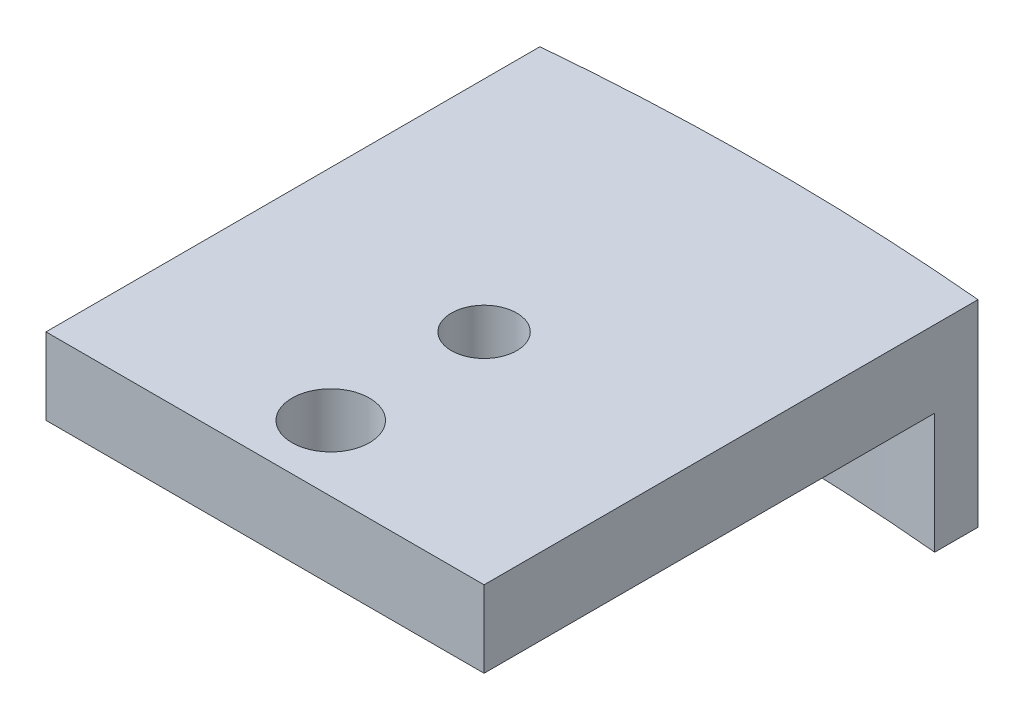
SolidWorks part; units mm, degrees
ref_plane "FRONT" through (0, 0, 0) normal (0, 0, 1) x (1, 0, 0)
ref_plane "TOP" through (0, 0, 0) normal (0, 1, 0) x (1, 0, 0)
ref_plane "RIGHT" through (0, 0, 0) normal (1, 0, 0) x (0, 0, -1)
ref_plane "DropoutMtgSurf" through (0, 1213.6437, 0) normal (0, 1, 0) x (-1, 0, 0)
sketch "Sketch1" plane through (0, 1213.6437, 0) normal (0, 1, 0) x (-1, 0, 0)
  line L0 (0, 50) -> (0, -50) construction
  line L1 (15.875, -175.496) -> (-15.875, -175.496) construction
  line L2 (15.875, -175.496) -> (15.875, -139.7)
  line L3 (15.875, -139.7) -> (-15.875, -139.7)
  line L4 (-15.875, -175.496) -> (-15.875, -139.7)
  line L5 (50, 0) -> (-50, 0) construction
  arc A0 (-15.875, -175.496) -> (15.875, -175.496) centre (0, 0) ccw
  dimension "D1" = 176.2125
  dimension "D2" = 15.875
  dimension "D3" = 139.7
extrude "Base-Extrude" add sketch "Sketch1" along normal blind 5.5562
sketch "Sketch2" plane through (0, 1213.6437, 0) normal (0, 1, 0) x (-1, 0, 0)
  line L0 (-15.875, -139.7) -> (-15.875, -175.496) construction
  line L1 (15.875, -175.496) -> (15.875, -139.7) construction
  line L2 (-15.875, -172.3588) -> (-15.875, -175.496)
  line L3 (15.875, -175.496) -> (15.875, -172.3588)
  arc A0 (-15.875, -175.496) -> (15.875, -175.496) centre (0, 0) ccw construction
  arc A2 (-15.875, -175.496) -> (15.875, -175.496) centre (0, 0) ccw
  arc A3 (-15.875, -172.3588) -> (15.875, -172.3588) centre (0, 0) ccw
  dimension "D1" = 173.0883
extrude "Boss-Extrude1" add sketch "Sketch2" against normal blind 8.7312
sketch "Sketch3" plane through (-9.0657, 1219.2, -134.1995) normal (0, 1, 0) x (-1, 0, 0)
  point P0 (-9.0657, -21.3755)
sketch "Sketch4" plane through (0, 1219.2, -155.575) normal (1, 0, 0) x (0, 0, 1)
  line L0 (0, 0) -> (0, 203.2)
  line L1 (0, 203.2) -> (2.1828, 203.2)
  line L2 (2.1828, 203.2) -> (2.1828, 14.2875)
  line L3 (2.1828, 14.2875) -> (2.3686, 14.2875)
  line L4 (2.3686, 14.2875) -> (2.3686, 0)
  line L5 (2.3686, 0) -> (0, 0)
  line L6 (0, 110) -> (0, -10) construction
  dimension "Diameter" = 4.3656
  dimension "Depth" = 203.2
  dimension "C-Bore Diameter" = 4.7371
  dimension "C-Bore Depth" = 14.2875
hole_wizard "Hole1" positions "Sketch3" profile "Sketch4" legacy
sketch "Sketch5" plane through (-22.803, 1219.2, -137.7717) normal (0, 1, 0) x (-1, 0, 0)
  line L0 (-22.803, -15.4348) -> (-22.803, -16.8111)
  line L10 (-20.4344, -17.8033) -> (-21.8108, -17.8033)
  line L11 (-20.7517, -18.9876) -> (-21.9437, -18.2994)
  line L12 (-20.4704, -18.2146) -> (-21.8258, -17.9756)
  line L13 (-20.5772, -18.6134) -> (-21.8706, -18.1427)
  line L14 (-21.6187, -19.8545) -> (-22.3069, -18.6626)
  line L15 (-21.2805, -19.6177) -> (-22.1652, -18.5634)
  line L16 (-21.9929, -20.029) -> (-22.4636, -18.7357)
  line L17 (-20.9885, -19.3258) -> (-22.0429, -18.4411)
  line L18 (-22.3917, -20.1359) -> (-22.6307, -18.7804)
  line L20 (-22.803, -18.7955) -> (-22.803, -20.1719)
  line L21 (-23.1423, -16.871) -> (-23.613, -15.5776)
  line L22 (-22.9752, -16.8262) -> (-23.2142, -15.4708)
  line L23 (-23.299, -16.9441) -> (-23.9872, -15.7521)
  line L24 (-23.4407, -17.0433) -> (-24.3254, -15.9889)
  line L25 (-23.6622, -17.3072) -> (-24.8542, -16.619)
  line L26 (-23.563, -17.1656) -> (-24.6174, -16.2808)
  line L27 (-23.7951, -17.8033) -> (-25.1715, -17.8033)
  line L31 (-23.7801, -17.631) -> (-25.1355, -17.392)
  line L32 (-23.7353, -17.464) -> (-25.0287, -16.9932)
  circle A0 centre (-22.803, -17.8033) radius 2.3686
  circle A1 centre (-22.803, -17.8033) radius 0.9922
  dimension "D12" = 10
  dimension "D18" = 4.7371
  dimension "D19" = 1.9844
  dimension "D1" = 10
  dimension "D10" = 10
  dimension "D11" = 10
  dimension "D13" = 10
  dimension "D14" = 10
  dimension "D15" = 10
  dimension "D16" = 10
  dimension "D17" = 10
other "PF_.18751"
sketch "Sketch6" plane through (0.3926, 1219.2, -145.3751) normal (0, 1, 0) x (-1, 0, 0)
  point P0 (0.3926, 0.9126)
sketch "Sketch7" plane through (0, 1219.2, -144.4625) normal (1, 0, 0) x (0, 0, 1)
  line L0 (0, 0) -> (0, 203.2)
  line L1 (0, 203.2) -> (2.8067, 203.2)
  line L2 (2.8067, 203.2) -> (2.8067, 0)
  line L3 (2.8067, 0) -> (0, 0)
  line L4 (0, 110) -> (0, -10) construction
  dimension "Diameter" = 5.6134
  dimension "Depth" = 203.2
hole_wizard "10-OV-DR1" positions "Sketch6" profile "Sketch7" legacy
